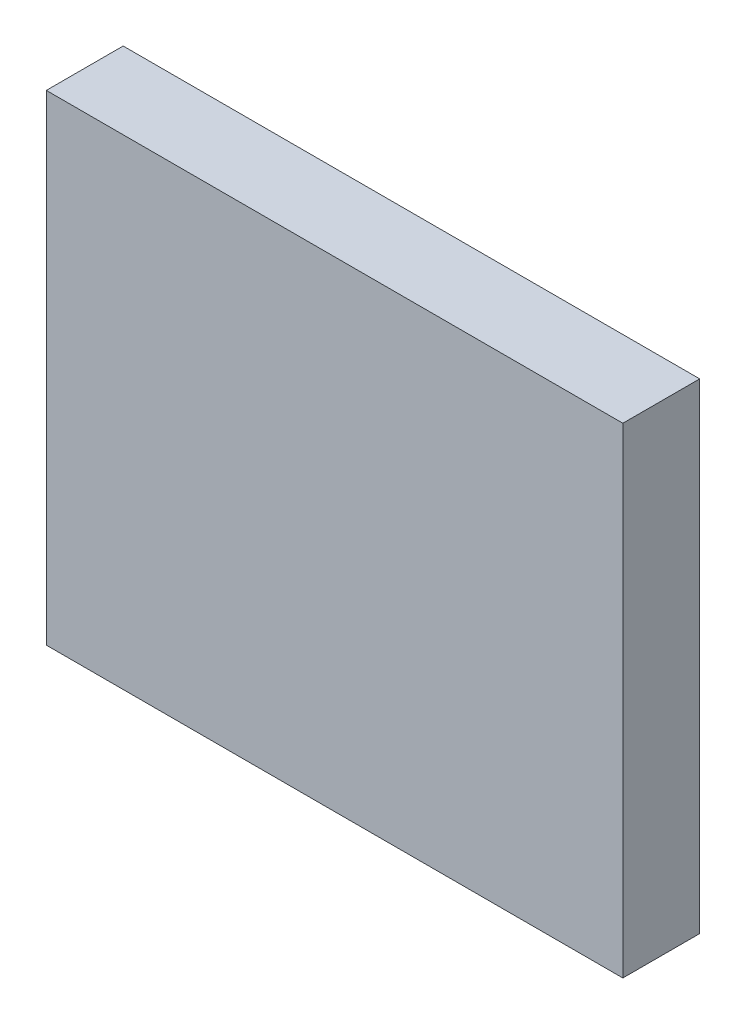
SolidWorks part; units mm, degrees
ref_plane "前视基准面" through (0, 0, 0) normal (0, 0, 1) x (1, 0, 0)
ref_plane "上视基准面" through (0, 0, 0) normal (0, 1, 0) x (1, 0, 0)
ref_plane "右视基准面" through (0, 0, 0) normal (1, 0, 0) x (0, 0, -1)
sketch "草图1" plane through (0, 0, 0) normal (0, 0, 1) x (1, 0, 0)
  line L1 (0, 0) -> (60, 0)
  line L2 (0, 0) -> (0, 50)
  line L3 (0, 50) -> (60, 50)
  line L4 (60, 0) -> (60, 50)
  dimension "D1" = 50
  dimension "D2" = 60
extrude "拉伸1" add sketch "草图1" along normal blind 8
